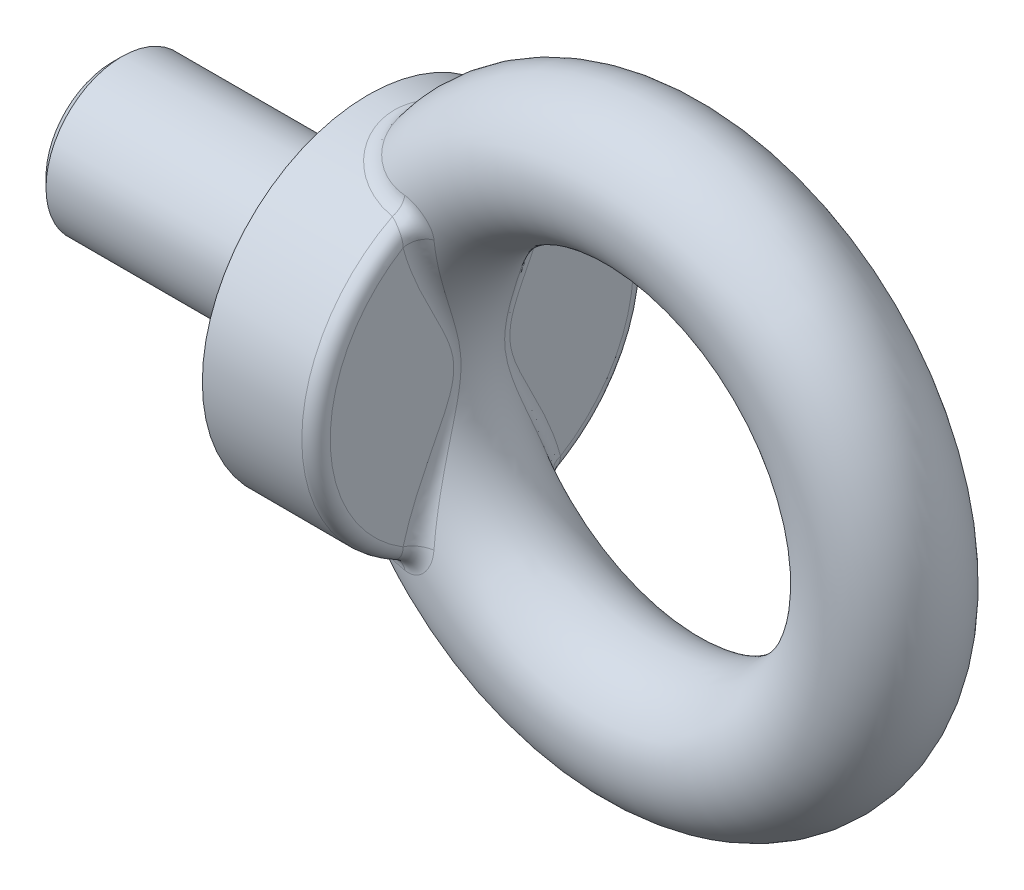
SolidWorks part; units mm, degrees
ref_plane "Plan de face" through (0, 0, 0) normal (0, 0, 1) x (1, 0, 0)
ref_plane "Plan de dessus" through (0, 0, 0) normal (0, 1, 0) x (1, 0, 0)
ref_plane "Plan de droite" through (0, 0, 0) normal (1, 0, 0) x (0, 0, -1)
sketch "Esquisse1" plane through (0, 0, 0) normal (0, 0, 1) x (1, 0, 0)
  line L0 (-79.9226, 0) -> (93.6161, 0) construction
  line L1 (0, 0) -> (0, 8)
  line L2 (0, 8) -> (26, 8)
  line L3 (26, 8) -> (26, 7)
  line L4 (26, 7) -> (27, 7)
  line L5 (27, 7) -> (27, 17.5)
  line L6 (27, 17.5) -> (37.5, 17.5)
  line L7 (39, 16) -> (39, 0)
  line L8 (0, 0) -> (39, 0)
  arc A0 (37.5, 17.5) -> (39, 16) centre (37.5, 16) cw
  dimension "D3" = 1.5
  dimension "D1" = 27
  dimension "D2" = 35
  dimension "D4" = 12
  dimension "D5" = 16
  dimension "D6" = 1
  dimension "D8" = 1
revolve "Révolution1" add sketch "Esquisse1" angle 360 about L0
chamfer "Chanfrein1" distance 1 angle 45 2 edges at (0, 0, 8) (26, 0, 8)
sketch "Esquisse4" plane through (0, 0, 0) normal (0, 0, 1) x (1, 0, 0)
  line L0 (27, 17.5) -> (27, -17.5) construction
  line L1 (32.5, 0) -> (81.5, 0) construction
  arc A0 (32.5, 0) -> (81.5, 0) centre (57, 0) ccw
  dimension "D1" = 49
  dimension "D3" = 30
sketch "Esquisse7" plane through (0, 0, 0) normal (0, 1, 0) x (1, 0, 0)
  line L0 (32.5, 0) -> (81.5, 0) construction
  line L1 (32.5, 0) -> (81.5, 0) construction
  circle A0 centre (81.5, 0) radius 7
  dimension "D1" = 14
sweep "Balayage2" add profiles "Esquisse7" path "Esquisse4"
mirror "Symétrie1" about plane through (0, 0, 0) normal (0, 1, 0)
fillet "Congé1" radius 2 8 edges at (39, 0.1723, -2.6001) (39, 0.1723, -2.6001) (38.4685, -15.6532, -6.9958) (30.867, -17.4751, -0.9341) (38.4196, -15.6958, 6.9978) (38.4685, 15.6532, -6.9958) (30.867, 17.4751, -0.9341) (38.4196, 15.6958, 6.9978)
sketch "Esquisse8" plane through (0, 0, 0) normal (0, 0, 1) x (1, 0, 0)
  line L0 (0, 8) -> (27, 17.5)
  line L1 (0, 7) -> (0, -7) construction
  line L8 (0, 8) -> (0, 0)
  line L9 (26, 8) -> (0, 8)
  line L10 (26, 7) -> (26, 8)
  line L11 (27, 7) -> (26, 7)
  line L12 (27, 17.5) -> (27, 7)
  line L13 (37.5, 17.5) -> (27, 17.5)
  line L14 (39, 0) -> (39, 16)
  line L15 (0, 0) -> (39, 0)
  line L17 (26, 8) -> (0, 8)
  line L18 (26, 7) -> (26, 8)
  line L19 (27, 7) -> (26, 7)
  line L20 (27, 17.5) -> (27, 7)
  arc A1 (39, 16) -> (37.5, 17.5) centre (37.5, 16) ccw
  dimension "D1" = 0
revolve "Enlèvement de matière-Révolution1" cut sketch "Esquisse8" angle 360 about axis through (-79.9226, 0, 0) along (1, 0, 0)
